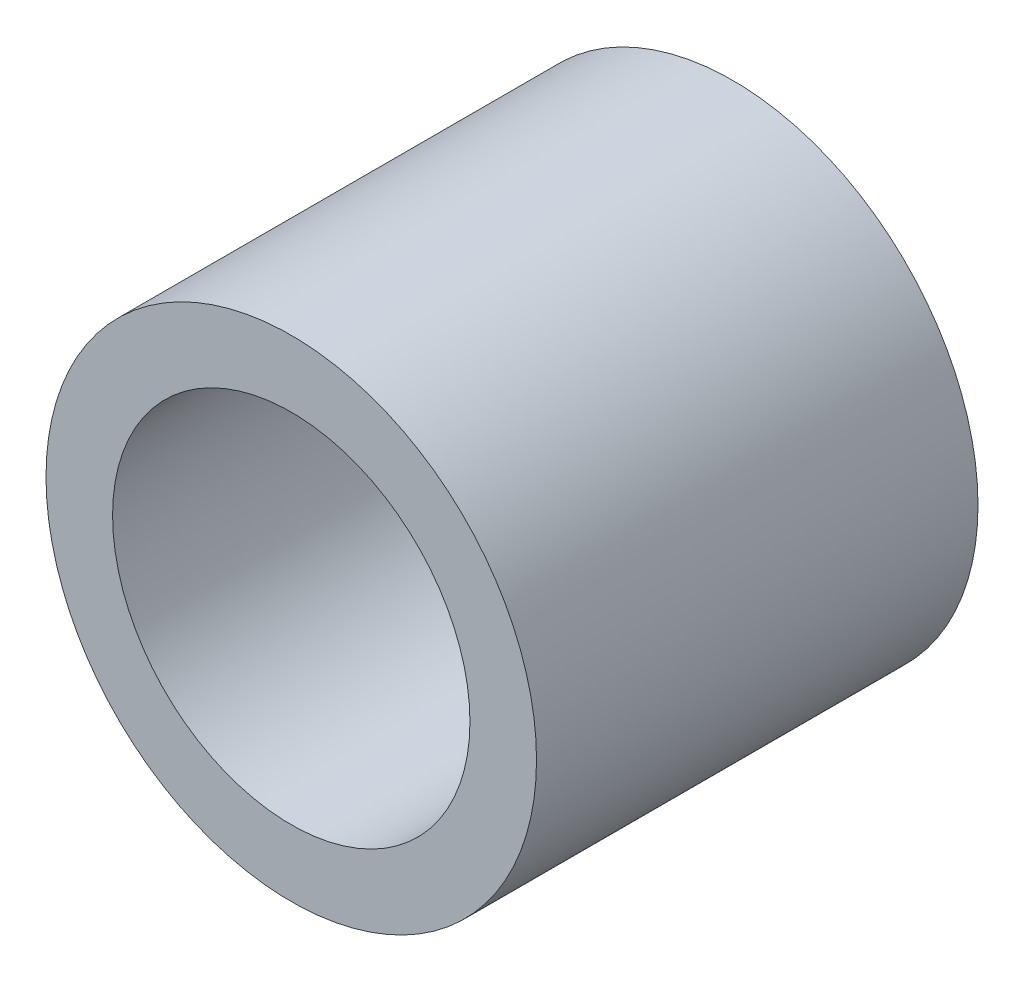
SolidWorks part; units mm, degrees
ref_plane "Plan de face" through (0, 0, 0) normal (0, 0, 1) x (1, 0, 0)
ref_plane "Plan de dessus" through (0, 0, 0) normal (0, 1, 0) x (1, 0, 0)
ref_plane "Plan de droite" through (0, 0, 0) normal (1, 0, 0) x (0, 0, -1)
sketch "Esquisse1" plane through (0, 0, 0) normal (0, 0, 1) x (1, 0, 0)
  circle A0 centre (0, 0) radius 17.5
  circle A1 centre (0, 0) radius 12.75
  dimension "D1" = 25.5
  dimension "D2" = 35
extrude "Extrusion1" add sketch "Esquisse1" along normal mid plane 31.5
